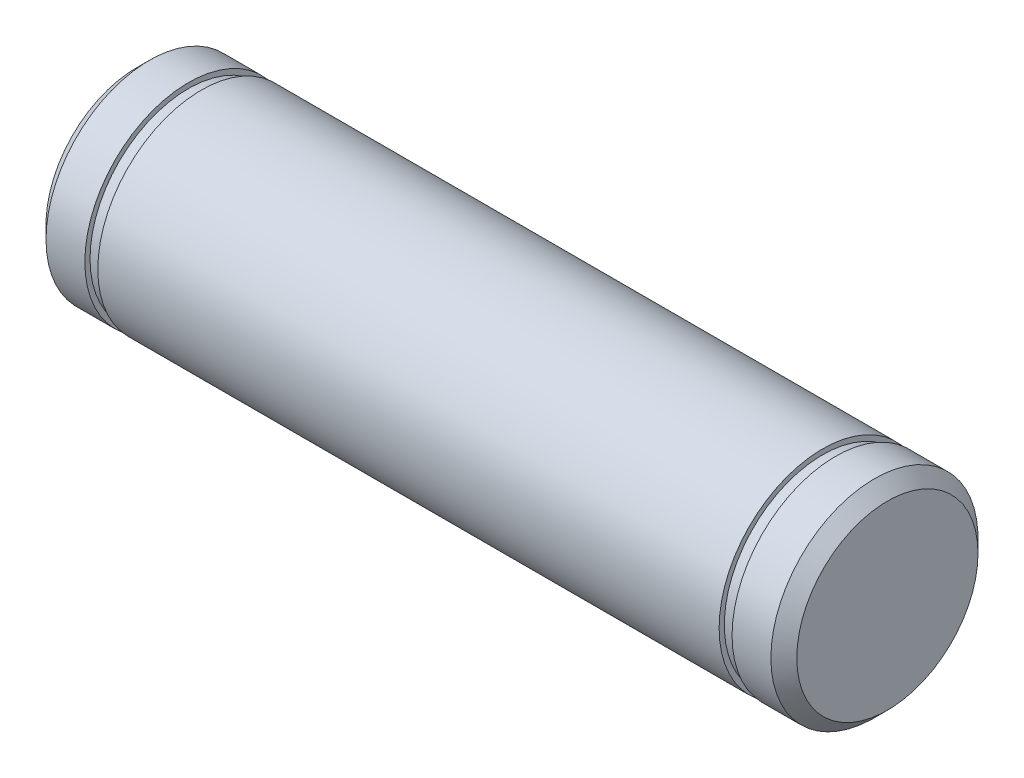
SolidWorks part; units mm, degrees
ref_plane "Front" through (0, 0, 0) normal (0, 0, 1) x (1, 0, 0)
ref_plane "Top" through (0, 0, 0) normal (0, 1, 0) x (1, 0, 0)
ref_plane "Right" through (0, 0, 0) normal (1, 0, 0) x (0, 0, -1)
sketch "Sketch1" plane through (0, 0, 0) normal (1, 0, 0) x (0, 0, -1)
  circle A0 centre (0, 0) radius 2
  dimension "D1" = 4
extrude "Boss-Extrude1" add sketch "Sketch1" along normal blind 14.5
sketch "Sketch2" plane through (14.5, 0, 0) normal (1, 0, 0) x (0, 0, -1)
  circle A0 centre (0, 0) radius 1.9
  circle A1 centre (0, 0) radius 2.4981
  dimension "D1" = 3.8
extrude "Cut-Extrude2" cut sketch "Sketch2" against normal blind 0.25 from offset 1
sketch "Sketch3" plane through (0, 0, 0) normal (-1, 0, 0) x (0, 0, 1)
  circle A0 centre (0, 0) radius 1.9
  circle A1 centre (0, 0) radius 2.5
extrude "Cut-Extrude3" cut sketch "Sketch3" against normal blind 0.25 from offset 1
chamfer "Chamfer1" distance 0.25 angle 45 2 edges at (14.5, 0, -2) (0, 0, -2)
